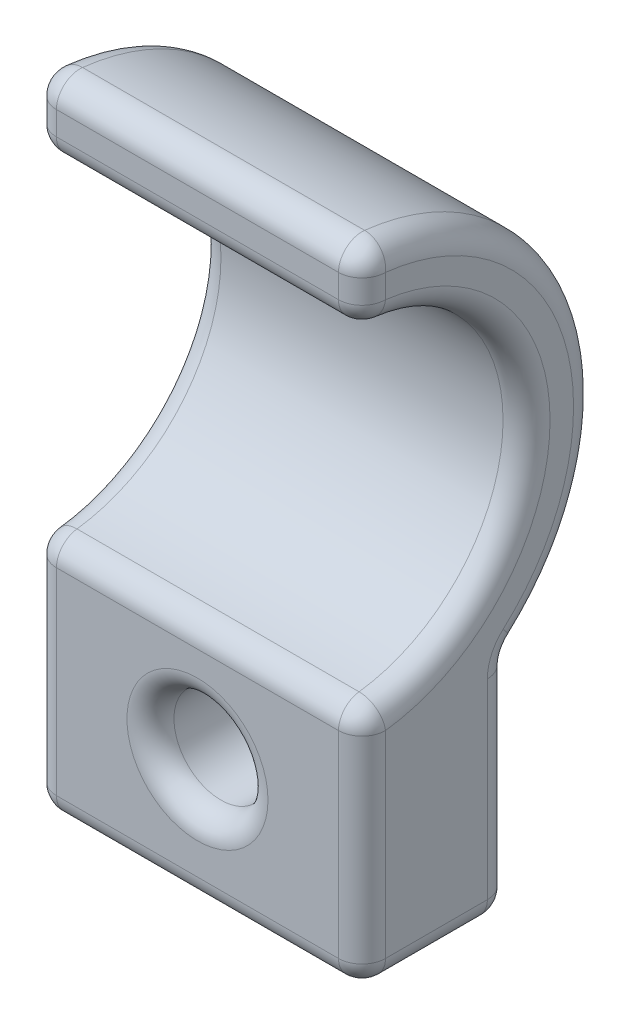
SolidWorks part; units mm, degrees
ref_plane "Alzado" through (0, 0, 0) normal (0, 0, 1) x (1, 0, 0)
ref_plane "Planta" through (0, 0, 0) normal (0, 1, 0) x (1, 0, 0)
ref_plane "Vista lateral" through (0, 0, 0) normal (1, 0, 0) x (0, 0, -1)
sketch "Croquis1" plane through (0, 0, 0) normal (1, 0, 0) x (0, 0, -1)
  line L0 (0, 0) -> (19, 0)
  line L1 (19, 0) -> (19, 28.7836)
  line L2 (0, 0) -> (0, 31)
  line L3 (0, 73) -> (0, 82)
  arc A0 (0, 31) -> (0, 73) centre (0, 52) ccw
  arc A1 (0, 82) -> (19, 28.7836) centre (0, 52) cw
  dimension "D2" = 30
  dimension "D3" = 21
  dimension "D1" = 19
  dimension "D4" = 9
  dimension "D5" = 52
extrude "Saliente-Extruir1" add sketch "Croquis1" against normal blind 42
sketch "Croquis2" plane through (0, 0, 0) normal (0, 0, 1) x (1, 0, 0)
  line L0 (-42, 0) -> (0, 0) construction
  circle A0 centre (-21, 16) radius 6
  dimension "D1" = 12
  dimension "D2" = 16
extrude "Cortar-Extruir1" cut sketch "Croquis2" against normal through all
fillet "Redondeo1" radius 3 20 edges at (-21, 73, 0) (-42, 0, -9.5) (-42, 77.5, 0) (-42, 52, -21) (-21, 82, 0) (-42, 62.0873, -28.2532) (-21, 28.7836, -19) (-42, 14.3918, -19) (-21, 0, -19) (-27, 16, -19) (0, 52, -21) (0, 77.5, 0) (0, 62.0873, -28.2532) (0, 14.3918, -19) (0, 0, -9.5) (-21, 0, 0) (-42, 15.5, 0) (-21, 31, 0) (0, 15.5, 0) (-15, 16, 0)
